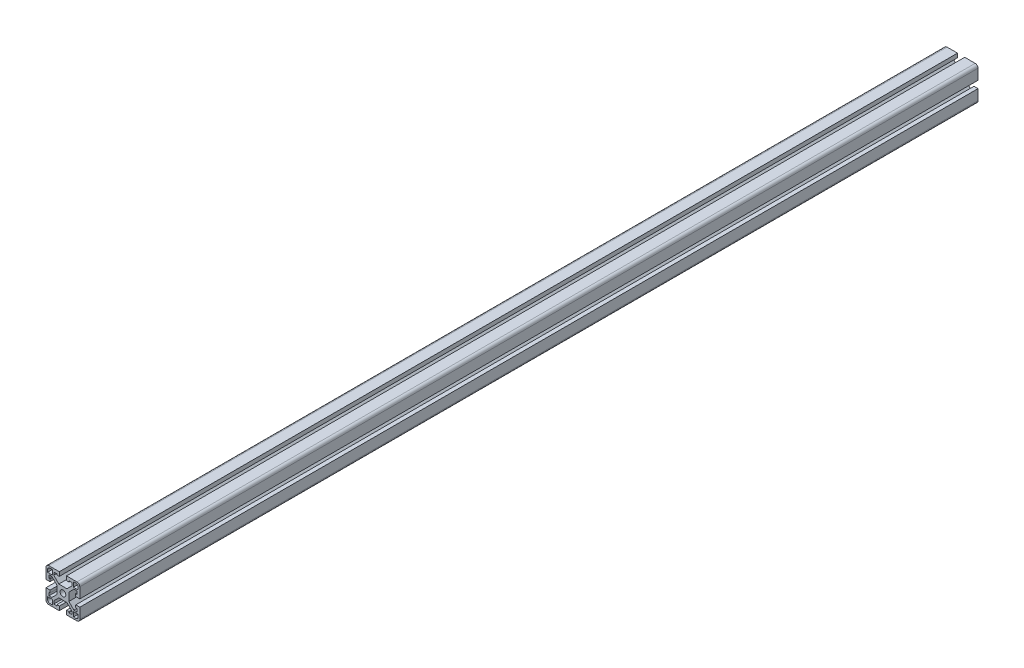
SolidWorks part; units mm, degrees
ref_plane "Front" through (0, 0, 0) normal (0, 0, 1) x (1, 0, 0)
ref_plane "Top" through (0, 0, 0) normal (0, 1, 0) x (1, 0, 0)
ref_plane "Right" through (0, 0, 0) normal (1, 0, 0) x (0, 0, -1)
sketch "Sketch1" plane through (0, 0, 0) normal (0, 0, 1) x (1, 0, 0)
  line L0 (-11.8872, 17.272) -> (-14.478, 17.272)
  line L1 (-11.8872, 11.8872) -> (-11.8872, 17.272)
  line L2 (-17.272, 11.8872) -> (-11.8872, 11.8872)
  line L3 (-17.272, 14.478) -> (-17.272, 11.8872)
  line L4 (14.478, 17.272) -> (11.8872, 17.272)
  line L5 (17.272, 11.8872) -> (17.272, 14.478)
  line L6 (11.8872, 11.8872) -> (17.272, 11.8872)
  line L7 (11.8872, 17.272) -> (11.8872, 11.8872)
  line L8 (11.8872, -17.272) -> (14.478, -17.272)
  line L9 (11.8872, -11.8872) -> (11.8872, -17.272)
  line L10 (17.272, -11.8872) -> (11.8872, -11.8872)
  line L11 (17.272, -14.478) -> (17.272, -11.8872)
  line L12 (-14.478, -17.272) -> (-11.8872, -17.272)
  line L13 (-17.272, -11.8872) -> (-17.272, -14.478)
  line L14 (-11.8872, -11.8872) -> (-17.272, -11.8872)
  line L15 (-11.8872, -17.272) -> (-11.8872, -11.8872)
  line L16 (-6.731, 4.5757) -> (-6.731, -4.5757)
  line L17 (-6.731, -4.5757) -> (-12.4423, -10.287)
  line L18 (-12.4423, -10.287) -> (-15.6718, -10.287)
  line L19 (-15.6718, -10.287) -> (-15.6718, -6.858)
  line L20 (-15.6718, -6.858) -> (-14.478, -6.858)
  line L21 (-14.478, -6.858) -> (-14.478, -4.064)
  line L22 (-14.478, -4.064) -> (-19.05, -4.064)
  line L23 (-19.05, -4.064) -> (-19.05, -15.875)
  line L24 (-15.875, -19.05) -> (-4.064, -19.05)
  line L25 (-4.064, -19.05) -> (-4.064, -14.478)
  line L26 (-4.064, -14.478) -> (-6.858, -14.478)
  line L27 (-6.858, -14.478) -> (-6.858, -15.6718)
  line L28 (-6.858, -15.6718) -> (-10.287, -15.6718)
  line L29 (-10.287, -15.6718) -> (-10.287, -12.4423)
  line L30 (-10.287, -12.4423) -> (-4.5757, -6.731)
  line L31 (-4.5757, -6.731) -> (4.5757, -6.731)
  line L32 (4.5757, -6.731) -> (10.287, -12.4423)
  line L33 (10.287, -12.4423) -> (10.287, -15.6718)
  line L34 (10.287, -15.6718) -> (6.858, -15.6718)
  line L35 (6.858, -15.6718) -> (6.858, -14.478)
  line L36 (6.858, -14.478) -> (4.064, -14.478)
  line L37 (4.064, -14.478) -> (4.064, -19.05)
  line L38 (4.064, -19.05) -> (15.875, -19.05)
  line L39 (19.05, -15.875) -> (19.05, -4.064)
  line L40 (19.05, -4.064) -> (14.478, -4.064)
  line L41 (14.478, -4.064) -> (14.478, -6.858)
  line L42 (14.478, -6.858) -> (15.6718, -6.858)
  line L43 (15.6718, -6.858) -> (15.6718, -10.287)
  line L44 (15.6718, -10.287) -> (12.4423, -10.287)
  line L45 (12.4423, -10.287) -> (6.731, -4.5757)
  line L46 (6.731, -4.5757) -> (6.731, 4.5757)
  line L47 (6.731, 4.5757) -> (12.4423, 10.287)
  line L48 (12.4423, 10.287) -> (15.6718, 10.287)
  line L49 (15.6718, 10.287) -> (15.6718, 6.858)
  line L50 (15.6718, 6.858) -> (14.478, 6.858)
  line L51 (14.478, 6.858) -> (14.478, 4.064)
  line L52 (14.478, 4.064) -> (19.05, 4.064)
  line L53 (19.05, 4.064) -> (19.05, 15.875)
  line L54 (15.875, 19.05) -> (4.064, 19.05)
  line L55 (4.064, 19.05) -> (4.064, 14.478)
  line L56 (4.064, 14.478) -> (6.858, 14.478)
  line L57 (6.858, 14.478) -> (6.858, 15.6718)
  line L58 (6.858, 15.6718) -> (10.287, 15.6718)
  line L59 (10.287, 15.6718) -> (10.287, 12.4423)
  line L60 (10.287, 12.4423) -> (4.5757, 6.731)
  line L61 (4.5757, 6.731) -> (-4.5757, 6.731)
  line L62 (-4.5757, 6.731) -> (-10.287, 12.4423)
  line L63 (-10.287, 12.4423) -> (-10.287, 15.6718)
  line L64 (-10.287, 15.6718) -> (-6.858, 15.6718)
  line L65 (-6.858, 15.6718) -> (-6.858, 14.478)
  line L66 (-6.858, 14.478) -> (-4.064, 14.478)
  line L67 (-4.064, 14.478) -> (-4.064, 19.05)
  line L68 (-4.064, 19.05) -> (-15.875, 19.05)
  line L69 (-19.05, 15.875) -> (-19.05, 4.064)
  line L70 (-19.05, 4.064) -> (-14.478, 4.064)
  line L71 (-14.478, 4.064) -> (-14.478, 6.858)
  line L72 (-14.478, 6.858) -> (-15.6718, 6.858)
  line L73 (-15.6718, 6.858) -> (-15.6718, 10.287)
  line L74 (-15.6718, 10.287) -> (-12.4423, 10.287)
  line L75 (-12.4423, 10.287) -> (-6.731, 4.5757)
  circle A0 centre (0, 0) radius 3.2639
  arc A1 (-19.05, -15.875) -> (-15.875, -19.05) centre (-15.875, -15.875) ccw
  arc A2 (15.875, -19.05) -> (19.05, -15.875) centre (15.875, -15.875) ccw
  arc A3 (19.05, 15.875) -> (15.875, 19.05) centre (15.875, 15.875) ccw
  arc A4 (-15.875, 19.05) -> (-19.05, 15.875) centre (-15.875, 15.875) ccw
  arc A5 (-14.478, 17.272) -> (-17.272, 14.478) centre (-14.478, 14.478) ccw
  arc A6 (17.272, 14.478) -> (14.478, 17.272) centre (14.478, 14.478) ccw
  arc A7 (14.478, -17.272) -> (17.272, -14.478) centre (14.478, -14.478) ccw
  arc A8 (-17.272, -14.478) -> (-14.478, -17.272) centre (-14.478, -14.478) ccw
extrude "Boss-Extrude1" add sketch "Sketch1" against normal up to surface (1012.825 mm away)
